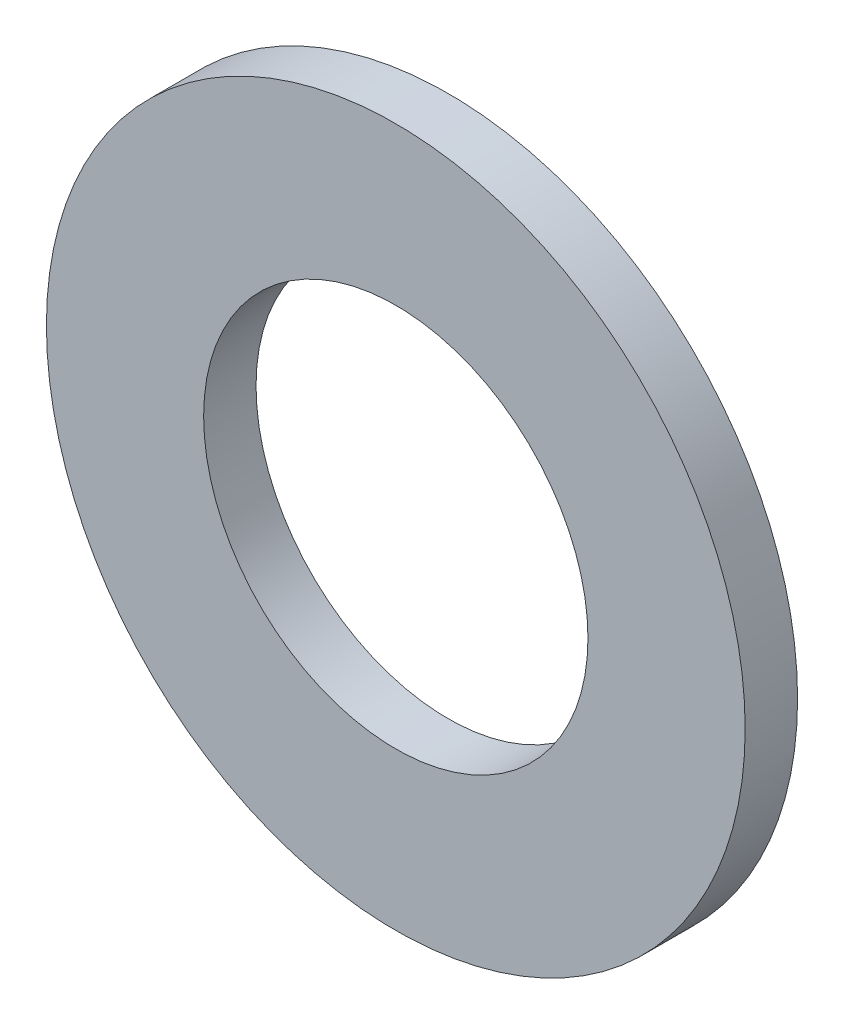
SolidWorks part; units mm, degrees
ref_plane "Plan1" through (0, 0, 0) normal (0, 0, 1) x (1, 0, 0)
ref_plane "Plan2" through (0, 0, 0) normal (0, 1, 0) x (1, 0, 0)
ref_plane "Plan3" through (0, 0, 0) normal (1, 0, 0) x (0, 0, -1)
sketch "Esquisse1" plane through (0, 0, 0) normal (0, 0, 1) x (1, 0, 0)
  circle A0 centre (0, 0) radius 11
  circle A1 centre (0, 0) radius 20
  dimension "D1" = 22
  dimension "D2" = 40
extrude "Base-Extrusion" add sketch "Esquisse1" along normal mid plane 3
